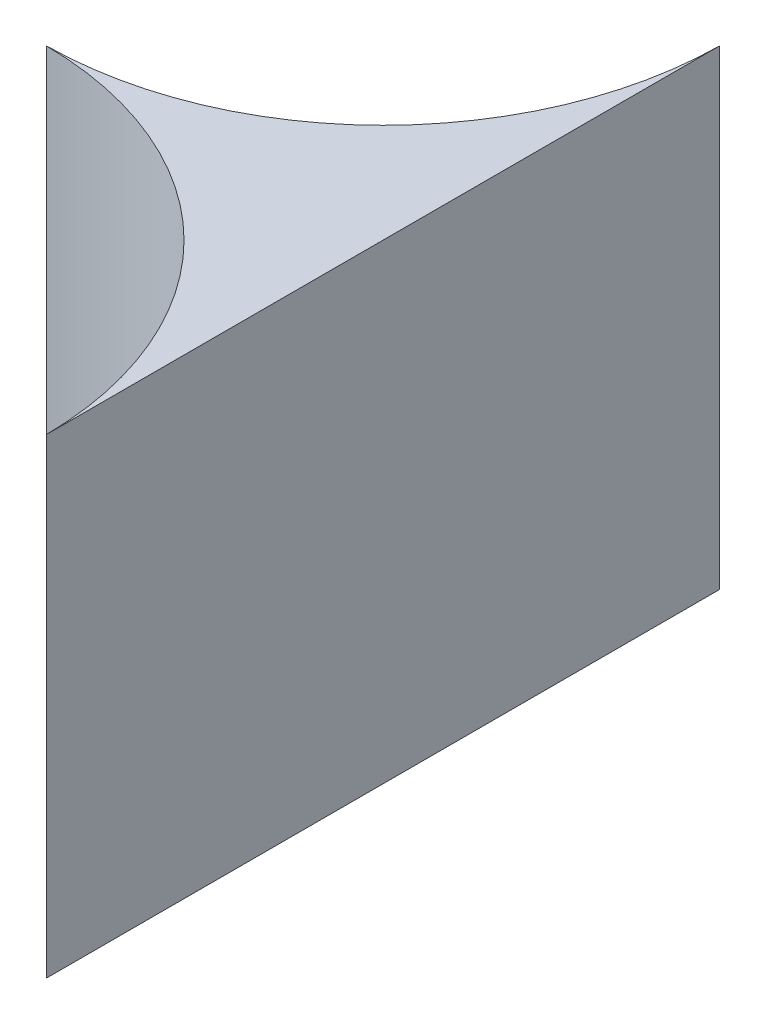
SolidWorks part; units mm, degrees
ref_plane "Front Plane" through (0, 0, 0) normal (0, 0, 1) x (1, 0, 0)
ref_plane "Top Plane" through (0, 0, 0) normal (0, 1, 0) x (1, 0, 0)
ref_plane "Right Plane" through (0, 0, 0) normal (1, 0, 0) x (0, 0, -1)
sketch "Sketch1" plane through (0, 0, 0) normal (0, 1, 0) x (1, 0, 0)
  line L1 (-25, -25) -> (25, -25)
  line L2 (-25, -25) -> (-25, 25)
  line L3 (-25, 25) -> (25, 25)
  line L4 (25, -25) -> (25, 25)
  line L5 (-25, -25) -> (25, 25) construction
  line L6 (-25, 25) -> (25, -25) construction
  line L7 (-25.25, -25.25) -> (25.25, -25.25) construction
  line L8 (-25.25, -25.25) -> (-25.25, 25.25) construction
  line L9 (-25.25, 25.25) -> (25.25, 25.25) construction
  line L10 (25.25, -25.25) -> (25.25, 25.25) construction
  line L11 (-25.25, -25.25) -> (25.25, 25.25) construction
  line L12 (-25.25, 25.25) -> (25.25, -25.25) construction
  circle A1 centre (-25.25, 25.25) radius 25.25
  circle A4 centre (25.25, 25.25) radius 25.25
  circle A5 centre (25.25, -25.25) radius 25.25
  circle A6 centre (-25.25, -25.25) radius 25.25
  point P0 (0, 0)
  point P6 (0, 0)
  dimension "D5" = 50.5
  dimension "D6" = 50.5
  dimension "D7" = 50.5
  dimension "D8" = 50.5
  dimension "D1" = 50
  dimension "D2" = 50
  dimension "D3" = 50.5
  dimension "D4" = 50.5
extrude "Boss-Extrude1" add sketch "Sketch1" along normal blind 35 contours A6 L4 A5 L3 A1 L2 A4 L1
sketch "Sketch2" plane through (0, 0, 0) normal (0, -1, 0) x (1, 0, 0)
  line L1 (-0.0012, 25) -> (25.25, 25)
  line L2 (-0.0012, 25) -> (-0.0012, -25.25)
  line L3 (-0.0012, -25.25) -> (25.25, -25.25)
  line L4 (25.25, 25) -> (25.25, -25.25)
extrude "Cut-Extrude1" cut sketch "Sketch2" against normal through all
scale "Scale1" scale about centroid uniform scaling yes scale factor 0.9
